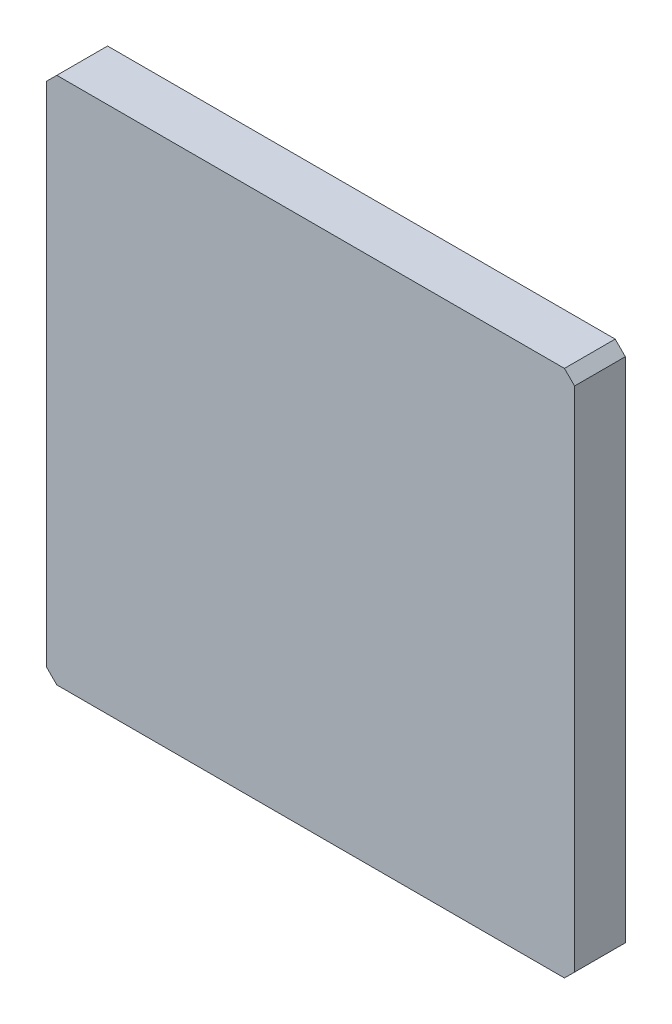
SolidWorks part; units mm, degrees
ref_plane "前视基准面" through (0, 0, 0) normal (0, 0, 1) x (1, 0, 0)
ref_plane "上视基准面" through (0, 0, 0) normal (0, 1, 0) x (1, 0, 0)
ref_plane "右视基准面" through (0, 0, 0) normal (1, 0, 0) x (0, 0, -1)
other "Configuration Table"
sketch "草图1" plane through (0, 0, 0) normal (0, 0, 1) x (1, 0, 0)
  line L1 (-2.6, 2.6) -> (2.6, 2.6)
  line L2 (-2.6, 2.6) -> (-2.6, -2.6)
  line L3 (-2.6, -2.6) -> (2.6, -2.6)
  line L4 (2.6, 2.6) -> (2.6, -2.6)
  line L5 (-2.6, 2.6) -> (2.6, -2.6) construction
  line L6 (-2.6, -2.6) -> (2.6, 2.6) construction
  point P0 (0, 0)
  dimension "D1" = 5.2
extrude "凸台-拉伸1" add sketch "草图1" along normal blind 0.5
chamfer "倒角1" distance 0.1 angle 45 4 edges at (-2.6, -2.6, 0.25) (-2.6, 2.6, 0.25) (2.6, -2.6, 0.25) (2.6, 2.6, 0.25)
